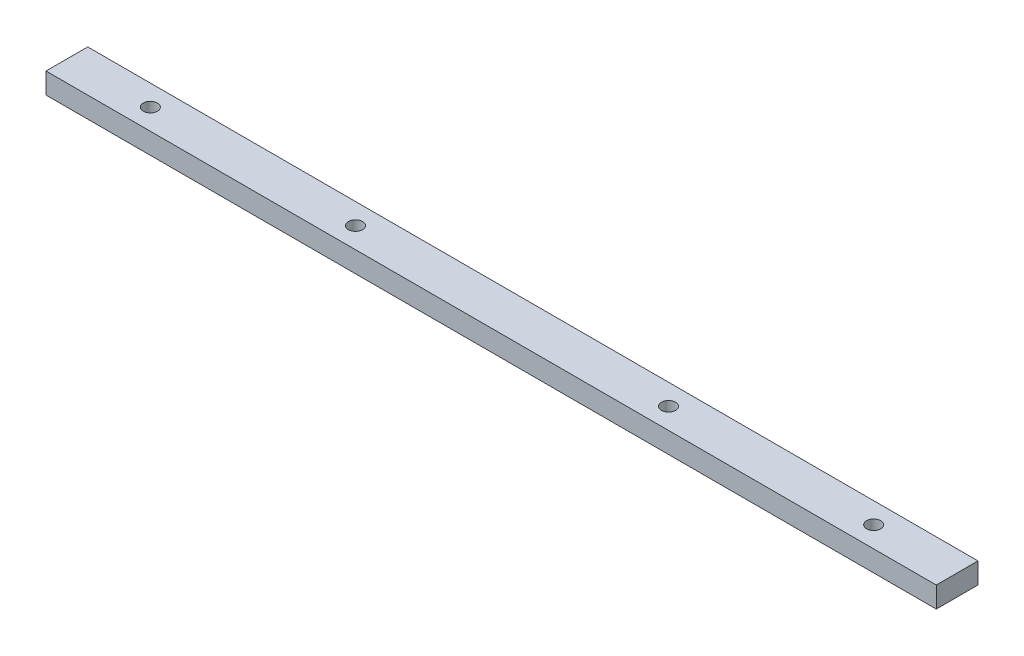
SolidWorks part; units mm, degrees
ref_plane "Plan de face" through (0, 0, 0) normal (0, 0, 1) x (1, 0, 0)
ref_plane "Plan de dessus" through (0, 0, 0) normal (0, 1, 0) x (1, 0, 0)
ref_plane "Plan de droite" through (0, 0, 0) normal (1, 0, 0) x (0, 0, -1)
sketch "Esquisse1" plane through (0, 0, 0) normal (1, 0, 0) x (0, 0, -1)
  line L1 (-15, 0) -> (15, 0)
  line L2 (-15, 0) -> (-15, -15)
  line L3 (-15, -15) -> (15, -15)
  line L4 (15, 0) -> (15, -15)
  dimension "D1" = 30
  dimension "D2" = 15
extrude "Extrusion1" add sketch "Esquisse1" along normal mid plane 640
hole_wizard "Trou taraudé M12x1.751" positions "Esquisse3" profile "Esquisse2" tap size "M12x1.75" standard "ISO"
sketch "Esquisse3" plane through (0, 0, 0) normal (0, 1, 0) x (-1, 0, 0)
  line L0 (-320, -15) -> (320, -15) construction
  line L1 (320, -15) -> (320, 15) construction
  point P0 (260, 0)
  point P1 (112.5, 0)
  point P2 (-112.5, 0)
  point P3 (-260, 0)
  dimension "D1" = 15
  dimension "D2" = 60
  dimension "D3" = 147.5
  dimension "D4" = 225
  dimension "D5" = 147.5
sketch "Esquisse2" plane through (-260, 0, 0) normal (1, 0, 0) x (0, 0, 1)
  line L0 (0, 0) -> (0, 15)
  line L1 (0, 15) -> (5.1, 15)
  line L2 (5.1, 15) -> (5.1, 0)
  line L5 (5.1, 0) -> (0, 0)
  line L11 (0, -6.35) -> (0, 107.95) construction
  dimension "Diamètre du trou pour taraudage jusqu'au prochain" = 10.2
  dimension "Profondeur du trou pour taraudage jusqu'au prochain" = 15
